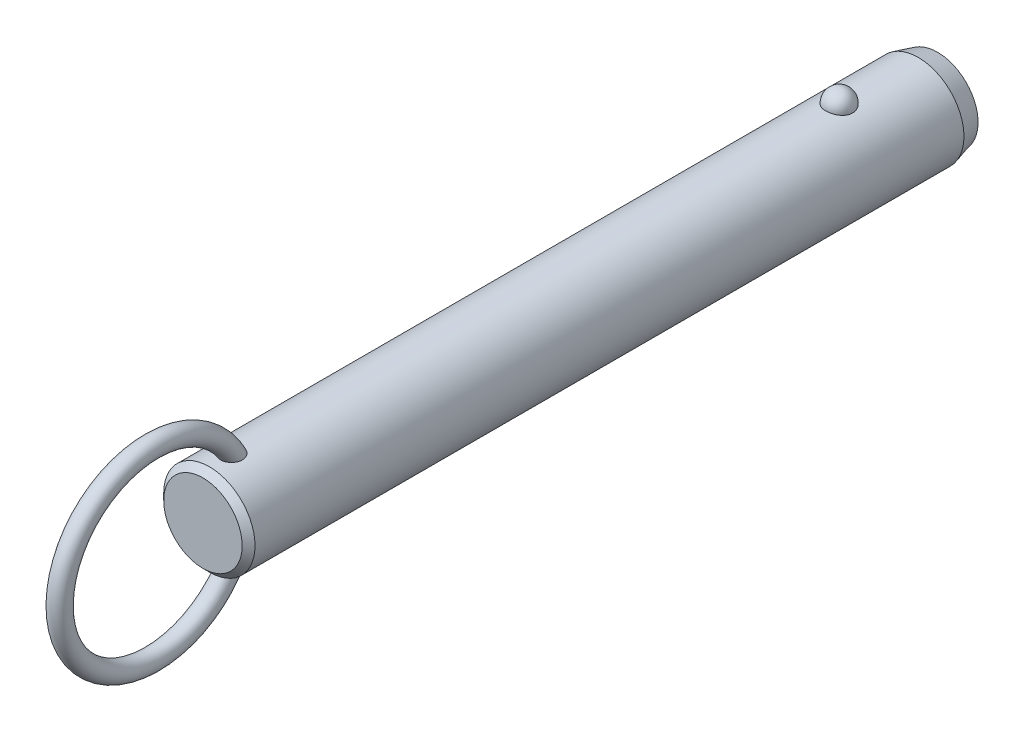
SolidWorks part; units mm, degrees
ref_plane "Front Plane" through (0, 0, 0) normal (0, 0, 1) x (1, 0, 0)
ref_plane "Top Plane" through (0, 0, 0) normal (0, 1, 0) x (1, 0, 0)
ref_plane "Right Plane" through (0, 0, 0) normal (1, 0, 0) x (0, 0, -1)
sketch "Sketch2" plane through (0, 0, 0) normal (0, 0, 1) x (1, 0, 0)
  circle A0 centre (0, 0) radius 7.1
  point P3 (0, 7.1)
  dimension "D1" = 14.2
extrude "Boss-Extrude1" add sketch "Sketch2" along normal blind 88.9
sketch "Sketch3" plane through (0, 0, 0) normal (0, 0, -1) x (-1, 0, 0)
  circle A0 centre (0, 0) radius 7.1
  dimension "D1" = 14.2
extrude "Boss-Extrude2" add sketch "Sketch3" along normal blind 17.4
chamfer "Chamfer1" distance 3 angle 15 1 edges at (-7.1, 0, -17.4)
sketch "Sketch12" plane through (0, 0, 0) normal (1, 0, 0) x (0, 0, -1)
  line L0 (-88.9, 7.1) -> (-88.9, -7.1) construction
  point P0 (-88.9, 0)
sketch "Sketch13" plane through (0, 0, 0) normal (1, 0, 0) x (0, 0, -1)
  circle A0 centre (-104.75, 0) radius 15.85
  point P2 (-88.9, 0)
  dimension "D1" = 31.7
sketch "Sketch14" plane through (0, 0, 0) normal (0, 1, 0) x (1, 0, 0)
  circle A0 centre (0, -90.4) radius 1.5
  point P2 (0, -88.9)
  dimension "D1" = 3
sweep "Sweep1" add profiles "Sketch14" path "Sketch13"
sketch "Sketch15" plane through (0, 0, 88.9) normal (0, 0, 1) x (1, 0, 0)
  circle A0 centre (0, 0) radius 7.1
  dimension "D1" = 14.2
extrude "Boss-Extrude3" add sketch "Sketch15" along normal blind 7.92
chamfer "Chamfer2" distance 1 angle 45 1 edges at (7.1, 0, 96.82)
sketch "Sketch18" plane through (0, 0, 0) normal (1, 0, 0) x (0, 0, -1)
  line L0 (14.4, 7.1) -> (-90.5792, 7.1) construction
  line L1 (2.1, 9.2) -> (2.1, 5)
  line L2 (-90.5792, -7.1) -> (14.4, -7.1) construction
  arc A0 (2.1, 9.2) -> (2.1, 5) centre (2.1, 7.1) ccw
  point P4 (0, 7.1)
  dimension "D1" = 16.3
revolve "Revolve1" add sketch "Sketch18" angle 360 about L1
